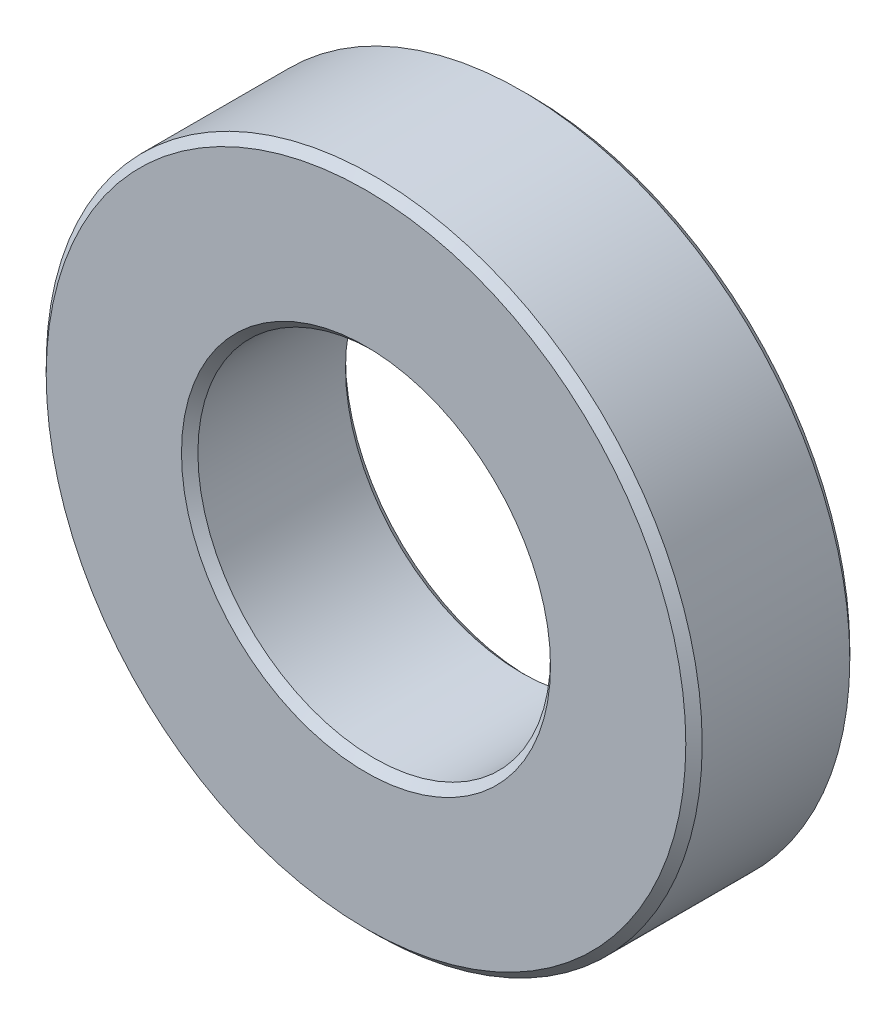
SolidWorks part; units mm, degrees
ref_plane "Front Plane" through (0, 0, 0) normal (0, 0, 1) x (1, 0, 0)
ref_plane "Top Plane" through (0, 0, 0) normal (0, 1, 0) x (1, 0, 0)
ref_plane "Right Plane" through (0, 0, 0) normal (1, 0, 0) x (0, 0, -1)
sketch "Sketch1" plane through (0, 0, 0) normal (0, 0, 1) x (1, 0, 0)
  circle A0 centre (0, 0) radius 4
  circle A1 centre (0, 0) radius 2.15
  dimension "D1" = 8
  dimension "D2" = 4.3
extrude "Boss-Extrude2" add sketch "Sketch1" along normal mid plane 2
chamfer "Chamfer3" distance 0.1 angle 45 4 edges at (4, 0, 1) (4, 0, -1) (2.15, 0, -1) (2.15, 0, 1)
